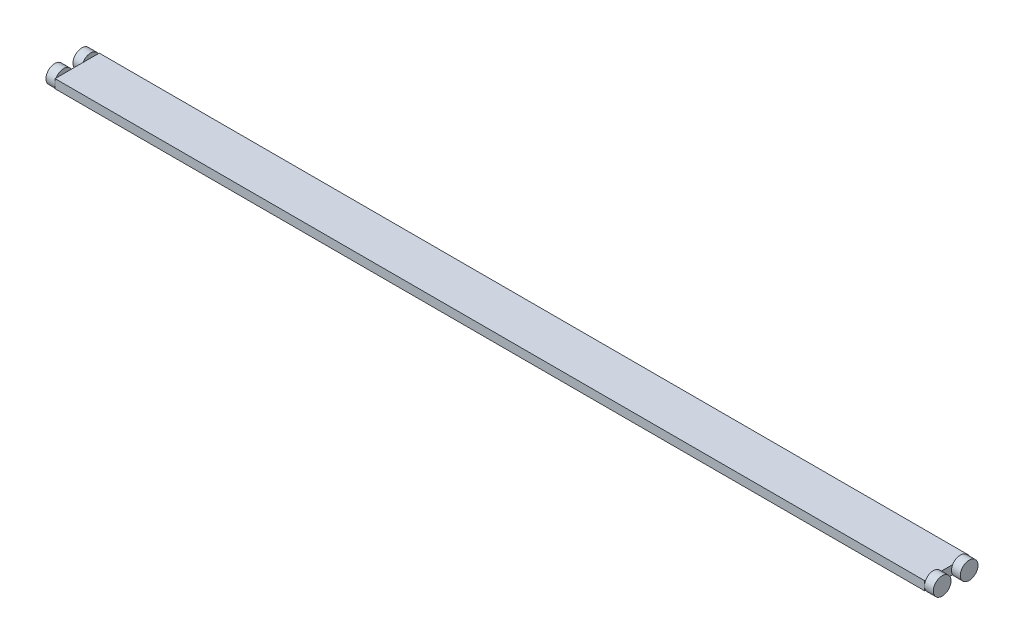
SolidWorks part; units mm, degrees
ref_plane "Ebene vorne" through (0, 0, 0) normal (0, 0, 1) x (1, 0, 0)
ref_plane "Ebene oben" through (0, 0, 0) normal (0, 1, 0) x (1, 0, 0)
ref_plane "Ebene rechts" through (0, 0, 0) normal (1, 0, 0) x (0, 0, -1)
sketch "Skizze1" plane through (0, 0, 0) normal (0, 1, 0) x (1, 0, 0)
  line L1 (-492, -25) -> (492, -25)
  line L2 (-492, -25) -> (-492, 25)
  line L3 (-492, 25) -> (492, 25)
  line L4 (492, -25) -> (492, 25)
  line L5 (-492, -25) -> (492, 25) construction
  line L6 (-492, 25) -> (492, -25) construction
  point P0 (0, 0)
  dimension "D1" = 50
  dimension "D2" = 984
extrude "Aufsatz-Linear austragen1" add sketch "Skizze1" along normal mid plane 10
sketch "Skizze2" plane through (492, 0, 0) normal (1, 0, 0) x (0, 0, -1)
  line L0 (-15.2829, 0) -> (15.2829, 0) construction
  circle A0 centre (15.2829, 0) radius 10
  circle A1 centre (-15.2829, 0) radius 10
  point P4 (0, 0)
  dimension "D1" = 20
  dimension "D2" = 30.5659
extrude "Aufsatz-Linear austragen2" add sketch "Skizze2" along normal blind 10
mirror "Spiegeln1" about plane through (0, 0, 0) normal (1, 0, 0) of "Aufsatz-Linear austragen2"
sketch "Skizze3" plane through (502, 0, 0) normal (1, 0, 0) x (0, 0, -1)
  point P0 (-15.2829, 0)
  point P1 (15.2829, 0)
sketch "Skizze4" plane through (-502, 0, 0) normal (-1, 0, 0) x (0, 0, 1)
  point P0 (-15.2829, 0)
  point P1 (15.2829, 0)
